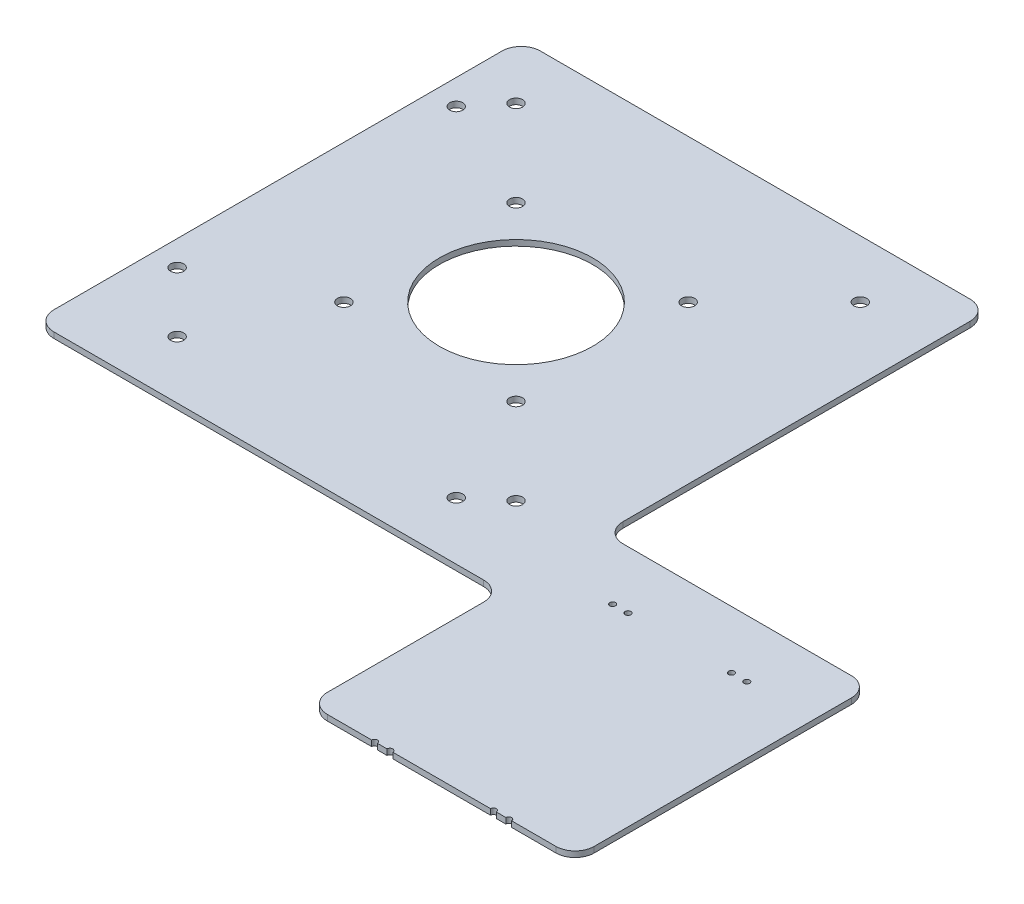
SolidWorks part; units mm, degrees
ref_plane "Plan de face" through (0, 0, 0) normal (0, 0, 1) x (1, 0, 0)
ref_plane "Plan de dessus" through (0, 0, 0) normal (0, 1, 0) x (1, 0, 0)
ref_plane "Plan de droite" through (0, 0, 0) normal (1, 0, 0) x (0, 0, -1)
sketch "Esquisse1" plane through (0, 0, 0) normal (0, 1, 0) x (1, 0, 0)
  line L0 (117.1, 119.8) -> (-107.1, 119.8)
  line L1 (-117.1, 109.8) -> (-117.1, -124)
  line L2 (-107.1, -134) -> (117.1, -134)
  line L3 (127.1, -144) -> (127.1, -225.5)
  line L4 (137.1, -235.5) -> (160.2, -235.5)
  line L5 (266.3, -225.5) -> (266.3, -91.3)
  line L6 (256.3, -81.3) -> (137.1, -81.3)
  line L7 (127.1, -71.3) -> (127.1, 109.8)
  line L8 (161.7, -111.3) -> (161.7, -235.5) construction
  line L9 (161.7, -173.4) -> (266.3, -173.4) construction
  line L10 (233.2, -235.5) -> (256.3, -235.5)
  line L11 (225.2, -235.5) -> (230.2, -235.5)
  line L12 (171.2, -235.5) -> (222.2, -235.5)
  line L13 (163.2, -235.5) -> (168.2, -235.5)
  circle A0 centre (0, 0) radius 40
  circle A1 centre (-104, 72.8) radius 3.4
  circle A2 centre (-89.8, 89.8) radius 3.4
  circle A3 centre (-44.9, 44.9) radius 3.4
  circle A4 centre (44.9, 44.9) radius 3.4
  circle A5 centre (44.9, -44.9) radius 3.4
  circle A6 centre (-44.9, -44.9) radius 3.4
  circle A7 centre (-104, -72.8) radius 3.4
  circle A8 centre (-72.8, -104) radius 3.4
  circle A9 centre (72.8, -104) radius 3.4
  circle A10 centre (89.8, -89.8) radius 3.4
  circle A11 centre (89.8, 89.8) radius 3.4
  arc A12 (266.3, -91.3) -> (256.3, -81.3) centre (256.3, -91.3) ccw
  arc A13 (256.3, -235.5) -> (266.3, -225.5) centre (256.3, -225.5) ccw
  arc A14 (127.1, -225.5) -> (137.1, -235.5) centre (137.1, -225.5) ccw
  arc A15 (117.1, -134) -> (127.1, -144) centre (117.1, -144) cw
  arc A16 (127.1, -71.3) -> (137.1, -81.3) centre (137.1, -71.3) ccw
  arc A17 (-117.1, -124) -> (-107.1, -134) centre (-107.1, -124) ccw
  arc A18 (-107.1, 119.8) -> (-117.1, 109.8) centre (-107.1, 109.8) ccw
  arc A19 (127.1, 109.8) -> (117.1, 119.8) centre (117.1, 109.8) ccw
  circle A20 centre (161.7, -111.3) radius 1.5
  circle A21 centre (169.7, -111.3) radius 1.5
  circle A22 centre (223.7, -111.3) radius 1.5
  circle A23 centre (231.7, -111.3) radius 1.5
  arc A24 (230.2, -235.5) -> (233.2, -235.5) centre (231.7, -235.5) cw
  arc A25 (222.2, -235.5) -> (225.2, -235.5) centre (223.7, -235.5) cw
  arc A26 (168.2, -235.5) -> (171.2, -235.5) centre (169.7, -235.5) cw
  arc A27 (160.2, -235.5) -> (163.2, -235.5) centre (161.7, -235.5) cw
  point P37 (266.3, -235.5)
  point P40 (127.1, -235.5)
  point P43 (127.1, -134)
  point P46 (127.1, -81.3)
  dimension "D1" = 80
  dimension "D2" = 6.8
  dimension "D4" = 30
  dimension "D6" = 134
  dimension "D13" = 89.8
  dimension "D24" = 10
  dimension "D29" = 3
  dimension "D3" = 13.1
  dimension "D5" = 119.8
  dimension "D7" = 117.1
  dimension "D8" = 127.1
  dimension "D9" = 37.3
  dimension "D10" = 30
  dimension "D11" = 72.8
  dimension "D12" = 72.8
  dimension "D14" = 89.8
  dimension "D15" = 72.8
  dimension "D16" = 72.8
  dimension "D17" = 44.9
  dimension "D18" = 44.9
  dimension "D19" = 44.9
  dimension "D20" = 44.9
  dimension "D21" = 139.2
  dimension "D22" = 154.2
  dimension "D23" = 81.3
  dimension "D25" = 8
  dimension "D26" = 8
  dimension "D27" = 54
  dimension "D28" = 42.6
  dimension "D30" = 30
  dimension "D31" = 62.1
extrude "Extrusion1" add sketch "Esquisse1" along normal blind 3
